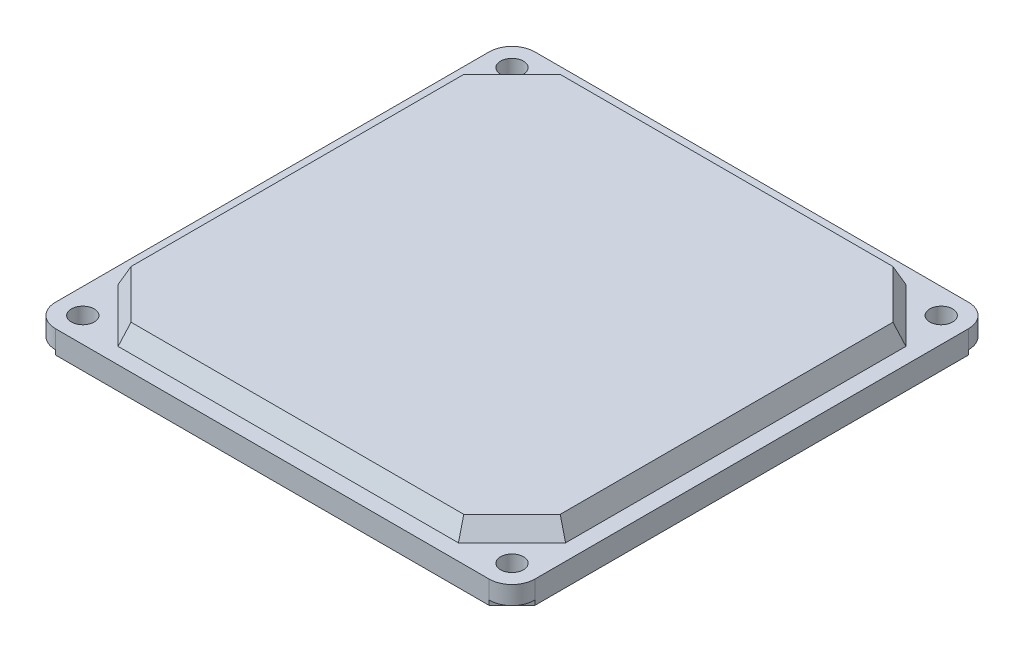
SolidWorks part; units mm, degrees
ref_plane "前视基准面" through (0, 0, 0) normal (0, 0, 1) x (1, 0, 0)
ref_plane "上视基准面" through (0, 0, 0) normal (0, 1, 0) x (1, 0, 0)
ref_plane "右视基准面" through (0, 0, 0) normal (1, 0, 0) x (0, 0, -1)
sketch "草图1" plane through (0, 0, 0) normal (0, 1, 0) x (1, 0, 0)
  line L1 (-52.5, -52.5) -> (52.5, -52.5)
  line L2 (-52.5, -52.5) -> (-52.5, 52.5)
  line L3 (-52.5, 52.5) -> (52.5, 52.5)
  line L4 (52.5, -52.5) -> (52.5, 52.5)
  line L5 (-52.5, -52.5) -> (52.5, 52.5) construction
  line L6 (-52.5, 52.5) -> (52.5, -52.5) construction
  point P0 (0, 0)
extrude "凸台-拉伸1" add sketch "草图1" along normal blind 5
sketch "草图2" plane through (0, 5, 0) normal (0, 1, 0) x (1, 0, 0)
  line L0 (0, 0) -> (-43.1335, 43.1335) construction
  line L1 (-37.267, -49) -> (37.267, -49)
  line L2 (-49, -37.267) -> (-49, 37.267)
  line L3 (-37.267, 49) -> (37.267, 49)
  line L4 (49, -37.267) -> (49, 37.267)
  line L5 (-43.1335, -43.1335) -> (43.1335, 43.1335) construction
  line L6 (-43.1335, 43.1335) -> (43.1335, -43.1335) construction
  line L9 (-37.267, 49) -> (-49, 37.267)
  line L10 (49, 37.267) -> (37.267, 49)
  line L11 (37.267, -49) -> (49, -37.267)
  line L12 (-49, -37.267) -> (-37.267, -49)
  point P0 (0, 0)
  point P18 (0, 0)
  dimension "D1" = 4
extrude "凸台-拉伸3" add sketch "草图2" along normal blind 4
chamfer "倒角1" distance 4 distance2 2 1 edges at (0, 9, 49)
chamfer "倒角2" distance 4 distance2 2 7 edges at (-44.1335, 9, 42.1335) (-49, 9, 0) (-43.1335, 9, -43.1335) (0, 9, -49) (43.1335, 9, -43.1335) (49, 9, 0) (44.1335, 9, 42.1335)
sketch "草图3" plane through (0, 5, 0) normal (0, 1, 0) x (1, 0, 0)
  circle A0 centre (47, 47) radius 2.5
  circle A1 centre (47, -47) radius 2.5
  circle A2 centre (-47, -47) radius 2.5
  circle A3 centre (-47, 47) radius 2.5
  point P17 (0, 0)
  dimension "D1" = 4
extrude "切除-拉伸1" cut sketch "草图3" against normal through all
sketch "草图4" plane through (0, 0, 0) normal (0, -1, 0) x (1, 0, 0)
  line L1 (-37.6812, -50) -> (37.6812, -50)
  line L2 (-50, -37.6812) -> (-50, 37.6812)
  line L3 (-37.6812, 50) -> (37.6812, 50)
  line L4 (50, -37.6812) -> (50, 37.6812)
  line L7 (50, 37.6812) -> (37.6812, 50)
  line L8 (-37.6812, 50) -> (-50, 37.6812)
  line L9 (37.6812, -50) -> (50, -37.6812)
  line L10 (-50, -37.6812) -> (-37.6812, -50)
  point P0 (0, 0)
  point P18 (0, 0)
  dimension "D1" = 4
extrude "切除-拉伸2" cut sketch "草图4" against normal blind 3
sketch "草图5" plane through (0, 3, 0) normal (0, -1, 0) x (1, 0, 0)
  line L0 (37.6812, 50) -> (-37.6812, 50) construction
  line L1 (-34.3675, -42) -> (34.3675, -42)
  line L2 (-42, -34.3675) -> (-42, 34.3675)
  line L3 (-34.3675, 42) -> (34.3675, 42)
  line L4 (42, -34.3675) -> (42, 34.3675)
  line L7 (-34.3675, 42) -> (-42, 34.3675)
  line L8 (-50, 37.6812) -> (-50, -37.6812) construction
  line L9 (-37.6812, 50) -> (-50, 37.6812) construction
  line L10 (-37.6812, -50) -> (37.6812, -50) construction
  line L11 (42, 34.3675) -> (34.3675, 42)
  line L12 (34.3675, -42) -> (42, -34.3675)
  line L13 (-42, -34.3675) -> (-34.3675, -42)
  point P0 (0, 0)
  point P25 (0, 0)
  dimension "D1" = 8
  dimension "D2" = 8
  dimension "D3" = 8
  dimension "D4" = 8
  dimension "D5" = 4
extrude "切除-拉伸3" cut sketch "草图5" against normal blind 4
chamfer "倒角3" distance 2 distance2 4 8 edges at (-38.1838, 3, -38.1838) (0, 3, -42) (38.1838, 3, -38.1838) (42, 3, 0) (38.1838, 3, 38.1838) (-42, 3, 0) (-38.1838, 3, 38.1838) (0, 3, 42)
sketch "草图6" plane through (0, 3, 0) normal (0, -1, 0) x (1, 0, 0)
  line L0 (24.5, 46) -> (30, 46)
  line L2 (30, 46) -> (35.5, 46)
  line L3 (0, 46) -> (5.5, 46)
  line L4 (6, 45.5) -> (6, 44.5)
  line L5 (-35.196, 44) -> (35.196, 44) construction
  line L6 (5.5, 44) -> (-5.5, 44)
  line L7 (-6, 44.5) -> (-6, 45.5)
  line L8 (-5.5, 46) -> (0, 46)
  line L9 (36, 45.5) -> (36, 44.5)
  line L10 (35.5, 44) -> (24.5, 44)
  line L11 (24, 44.5) -> (24, 45.5)
  line L12 (-35.5, 46) -> (-30, 46)
  line L13 (-30, 46) -> (-24.5, 46)
  line L14 (-24, 45.5) -> (-24, 44.5)
  line L15 (-24.5, 44) -> (-35.5, 44)
  line L16 (-36, 44.5) -> (-36, 45.5)
  line L17 (46, 35.5) -> (46, 30)
  line L18 (46, 30) -> (46, 24.5)
  line L19 (45.5, 24) -> (44.5, 24)
  line L20 (44, 24.5) -> (44, 35.5)
  line L21 (44.5, 36) -> (45.5, 36)
  line L22 (46, 5.5) -> (46, 0)
  line L23 (46, 0) -> (46, -5.5)
  line L24 (45.5, -6) -> (44.5, -6)
  line L25 (44, -5.5) -> (44, 5.5)
  line L26 (44.5, 6) -> (45.5, 6)
  line L27 (46, -24.5) -> (46, -30)
  line L28 (46, -30) -> (46, -35.5)
  line L29 (45.5, -36) -> (44.5, -36)
  line L30 (44, -35.5) -> (44, -24.5)
  line L31 (44.5, -24) -> (45.5, -24)
  line L32 (35.5, -46) -> (30, -46)
  line L33 (30, -46) -> (24.5, -46)
  line L34 (24, -45.5) -> (24, -44.5)
  line L35 (24.5, -44) -> (35.5, -44)
  line L36 (36, -44.5) -> (36, -45.5)
  line L37 (5.5, -46) -> (0, -46)
  line L38 (0, -46) -> (-5.5, -46)
  line L39 (-6, -45.5) -> (-6, -44.5)
  line L40 (-5.5, -44) -> (5.5, -44)
  line L41 (6, -44.5) -> (6, -45.5)
  line L42 (-24.5, -46) -> (-30, -46)
  line L43 (-30, -46) -> (-35.5, -46)
  line L44 (-36, -45.5) -> (-36, -44.5)
  line L45 (-35.5, -44) -> (-24.5, -44)
  line L46 (-24, -44.5) -> (-24, -45.5)
  line L47 (-46, -35.5) -> (-46, -30)
  line L48 (-46, -30) -> (-46, -24.5)
  line L49 (-45.5, -24) -> (-44.5, -24)
  line L50 (-44, -24.5) -> (-44, -35.5)
  line L51 (-44.5, -36) -> (-45.5, -36)
  line L52 (-46, -5.5) -> (-46, 0)
  line L53 (-46, 0) -> (-46, 5.5)
  line L54 (-45.5, 6) -> (-44.5, 6)
  line L55 (-44, 5.5) -> (-44, -5.5)
  line L56 (-44.5, -6) -> (-45.5, -6)
  line L57 (-46, 24.5) -> (-46, 30)
  line L58 (-46, 30) -> (-46, 35.5)
  line L59 (-45.5, 36) -> (-44.5, 36)
  line L60 (-44, 35.5) -> (-44, 24.5)
  line L61 (-44.5, 24) -> (-45.5, 24)
  arc A0 (6, 45.5) -> (5.5, 46) centre (5.5, 45.5) ccw
  arc A1 (6, 44.5) -> (5.5, 44) centre (5.5, 44.5) cw
  arc A2 (-5.5, 44) -> (-6, 44.5) centre (-5.5, 44.5) cw
  arc A3 (-6, 45.5) -> (-5.5, 46) centre (-5.5, 45.5) cw
  arc A4 (24, 45.5) -> (24.5, 46) centre (24.5, 45.5) cw
  arc A5 (36, 45.5) -> (35.5, 46) centre (35.5, 45.5) ccw
  arc A6 (36, 44.5) -> (35.5, 44) centre (35.5, 44.5) cw
  arc A7 (24.5, 44) -> (24, 44.5) centre (24.5, 44.5) cw
  arc A8 (-36, 45.5) -> (-35.5, 46) centre (-35.5, 45.5) cw
  arc A9 (-24, 45.5) -> (-24.5, 46) centre (-24.5, 45.5) ccw
  arc A10 (-24, 44.5) -> (-24.5, 44) centre (-24.5, 44.5) cw
  arc A11 (-35.5, 44) -> (-36, 44.5) centre (-35.5, 44.5) cw
  arc A12 (45.5, 24) -> (46, 24.5) centre (45.5, 24.5) ccw
  arc A13 (44.5, 24) -> (44, 24.5) centre (44.5, 24.5) cw
  arc A14 (44, 35.5) -> (44.5, 36) centre (44.5, 35.5) cw
  arc A15 (45.5, 36) -> (46, 35.5) centre (45.5, 35.5) cw
  arc A16 (45.5, 6) -> (46, 5.5) centre (45.5, 5.5) cw
  arc A17 (45.5, -6) -> (46, -5.5) centre (45.5, -5.5) ccw
  arc A18 (44.5, -6) -> (44, -5.5) centre (44.5, -5.5) cw
  arc A19 (44, 5.5) -> (44.5, 6) centre (44.5, 5.5) cw
  arc A20 (45.5, -36) -> (46, -35.5) centre (45.5, -35.5) ccw
  arc A21 (44.5, -36) -> (44, -35.5) centre (44.5, -35.5) cw
  arc A22 (44, -24.5) -> (44.5, -24) centre (44.5, -24.5) cw
  arc A23 (45.5, -24) -> (46, -24.5) centre (45.5, -24.5) cw
  arc A24 (24, -45.5) -> (24.5, -46) centre (24.5, -45.5) ccw
  arc A25 (24, -44.5) -> (24.5, -44) centre (24.5, -44.5) cw
  arc A26 (35.5, -44) -> (36, -44.5) centre (35.5, -44.5) cw
  arc A27 (36, -45.5) -> (35.5, -46) centre (35.5, -45.5) cw
  arc A28 (6, -45.5) -> (5.5, -46) centre (5.5, -45.5) cw
  arc A29 (-6, -45.5) -> (-5.5, -46) centre (-5.5, -45.5) ccw
  arc A30 (-6, -44.5) -> (-5.5, -44) centre (-5.5, -44.5) cw
  arc A31 (5.5, -44) -> (6, -44.5) centre (5.5, -44.5) cw
  arc A32 (-36, -45.5) -> (-35.5, -46) centre (-35.5, -45.5) ccw
  arc A33 (-36, -44.5) -> (-35.5, -44) centre (-35.5, -44.5) cw
  arc A34 (-24.5, -44) -> (-24, -44.5) centre (-24.5, -44.5) cw
  arc A35 (-24, -45.5) -> (-24.5, -46) centre (-24.5, -45.5) cw
  arc A36 (-45.5, -24) -> (-46, -24.5) centre (-45.5, -24.5) ccw
  arc A37 (-44.5, -24) -> (-44, -24.5) centre (-44.5, -24.5) cw
  arc A38 (-44, -35.5) -> (-44.5, -36) centre (-44.5, -35.5) cw
  arc A39 (-45.5, -36) -> (-46, -35.5) centre (-45.5, -35.5) cw
  arc A40 (-45.5, -6) -> (-46, -5.5) centre (-45.5, -5.5) cw
  arc A41 (-45.5, 6) -> (-46, 5.5) centre (-45.5, 5.5) ccw
  arc A42 (-44.5, 6) -> (-44, 5.5) centre (-44.5, 5.5) cw
  arc A43 (-44, -5.5) -> (-44.5, -6) centre (-44.5, -5.5) cw
  arc A44 (-45.5, 36) -> (-46, 35.5) centre (-45.5, 35.5) ccw
  arc A45 (-44.5, 36) -> (-44, 35.5) centre (-44.5, 35.5) cw
  arc A46 (-44, 24.5) -> (-44.5, 24) centre (-44.5, 24.5) cw
  arc A47 (-45.5, 24) -> (-46, 24.5) centre (-45.5, 24.5) cw
  point P10 (6, 44)
  point P15 (-6, 44)
  point P164 (0, 0)
  dimension "D1" = 0.5
  dimension "D2" = 2
  dimension "D3" = 2
  dimension "D4" = 4
extrude "凸台-拉伸4" add sketch "草图6" along normal up to surface (3 mm away)
fillet "圆角1" radius 5 3 edges at (52.5, 2.5, -52.5) (52.5, 2.5, 52.5) (-52.5, 2.5, 52.5)
sketch "草图7" plane through (0, 0, 0) normal (0, -1, 0) x (-1, 0, 0)
  line L0 (52.5, -47.5) -> (47.5, -52.5)
  line L3 (52.5, 52.5) -> (52.5, -47.5) construction
  line L4 (47.5, -52.5) -> (49.2968, -54.2968)
  line L5 (49.2968, -54.2968) -> (54.2968, -49.2968)
  line L6 (54.2968, -49.2968) -> (52.5, -47.5)
  line L7 (-49.2968, -54.2968) -> (-47.5, -52.5)
  line L8 (-47.5, -52.5) -> (-52.5, -47.5)
  line L9 (-52.5, -47.5) -> (-54.2968, -49.2968)
  line L10 (-54.2968, -49.2968) -> (-49.2968, -54.2968)
  line L11 (-54.2968, 49.2968) -> (-52.5, 47.5)
  line L12 (-52.5, 47.5) -> (-47.5, 52.5)
  line L13 (-47.5, 52.5) -> (-49.2968, 54.2968)
  line L14 (-49.2968, 54.2968) -> (-54.2968, 49.2968)
  line L15 (49.2968, 54.2968) -> (47.5, 52.5)
  line L16 (47.5, 52.5) -> (52.5, 47.5)
  line L17 (52.5, 47.5) -> (54.2968, 49.2968)
  line L18 (54.2968, 49.2968) -> (49.2968, 54.2968)
  point P22 (0, 0)
  dimension "D1" = 4
extrude "切除-拉伸4" cut sketch "草图7" against normal blind 1
fillet "圆角2" radius 5 1 edges at (-52.5, 2.5, -52.5)
